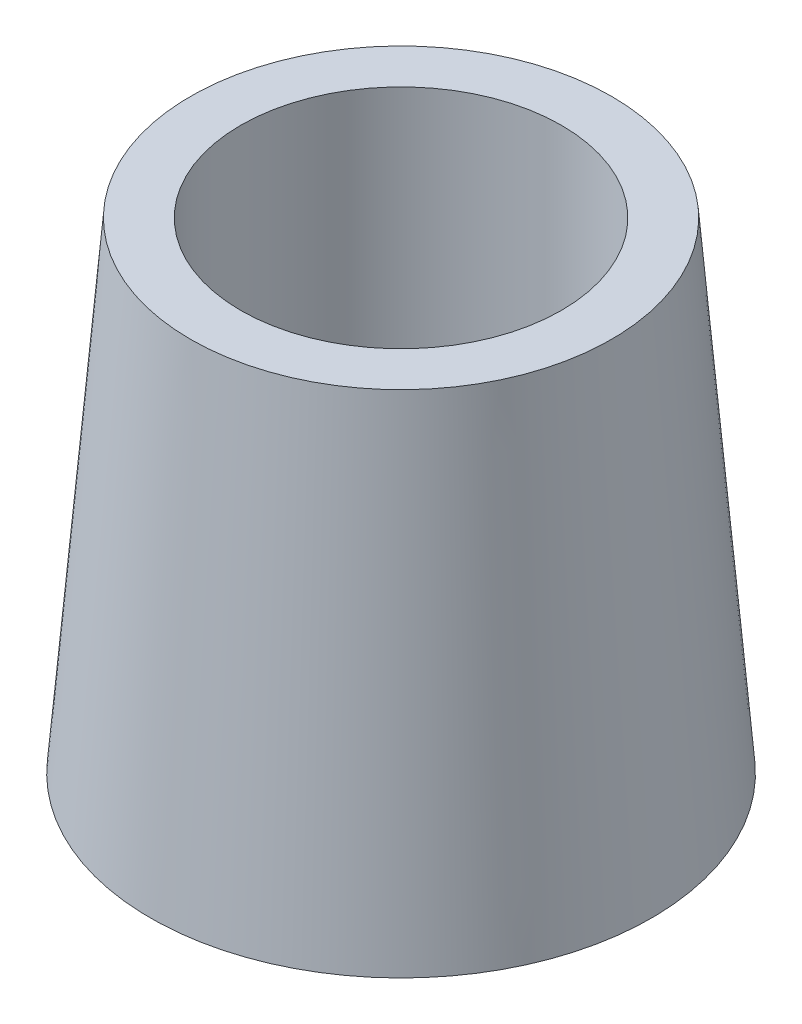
SolidWorks part; units mm, degrees
ref_plane "Front" through (0, 0, 0) normal (0, 0, 1) x (1, 0, 0)
ref_plane "Top" through (0, 0, 0) normal (0, 1, 0) x (1, 0, 0)
ref_plane "Right" through (0, 0, 0) normal (1, 0, 0) x (0, 0, -1)
sketch "Sketch1" plane through (0, 0, 0) normal (0, 0, 1) x (1, 0, 0)
  line L0 (0, 0) -> (0, 37.2159) construction
  line L1 (8, 0) -> (8, 24)
  line L2 (8, 24) -> (10.5, 24)
  line L3 (10.5, 24) -> (12.5, 0)
  line L4 (12.5, 0) -> (8, 0)
  dimension "D1" = 16
  dimension "D2" = 25
  dimension "D3" = 21
  dimension "D4" = 24
revolve "Revolve1" add sketch "Sketch1" angle 360 about L0
